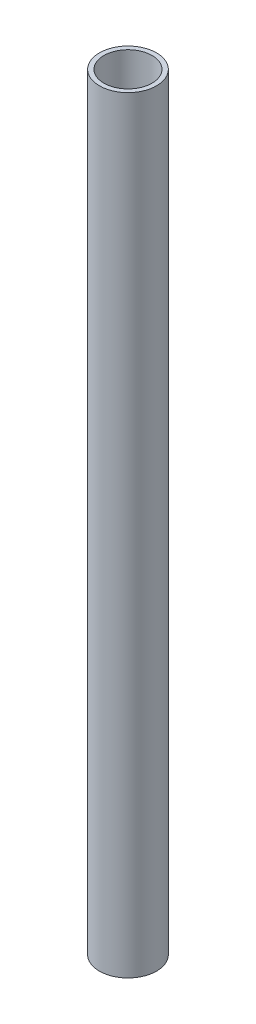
SolidWorks part; units mm, degrees
ref_plane "Front Plane" through (0, 0, 0) normal (0, 0, 1) x (1, 0, 0)
ref_plane "Top Plane" through (0, 0, 0) normal (0, 1, 0) x (1, 0, 0)
ref_plane "Right Plane" through (0, 0, 0) normal (1, 0, 0) x (0, 0, -1)
sketch "Sketch2" plane through (0, 0, 0) normal (0, 1, 0) x (1, 0, 0)
  circle A0 centre (0, 0) radius 19
  dimension "D1" = 38
extrude "Extrude-Thin1" add sketch "Sketch2" along normal mid plane 510 thin
